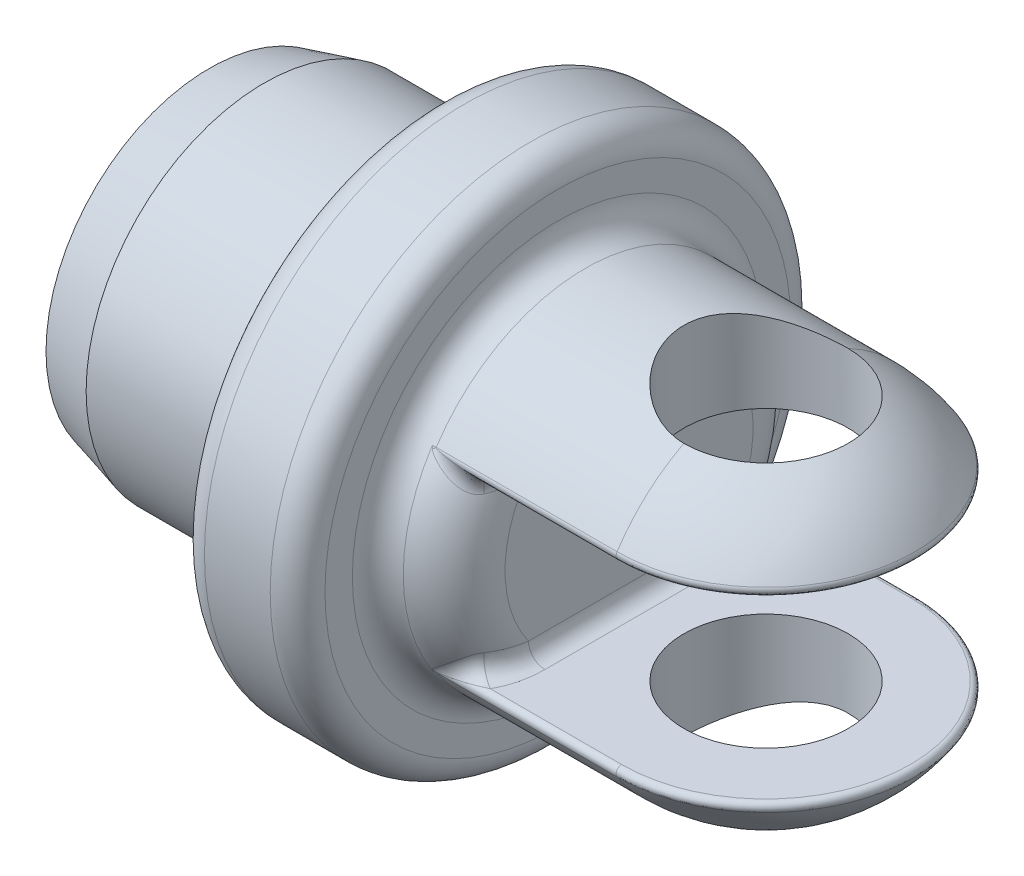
SolidWorks part; units mm, degrees
ref_plane "Plan de face" through (0, 0, 0) normal (0, 0, 1) x (1, 0, 0)
ref_plane "Plan de dessus" through (0, 0, 0) normal (0, 1, 0) x (1, 0, 0)
ref_plane "Plan de droite" through (0, 0, 0) normal (1, 0, 0) x (0, 0, -1)
sketch "Esquisse1" plane through (0, 0, 0) normal (0, 0, 1) x (1, 0, 0)
  line L0 (-118.3632, -0.002) -> (245.5511, -0.002) construction
  line L1 (-38.9994, -23.385) -> (-38.9994, -23.387)
  line L2 (-34.9994, -21.75) -> (-34.9994, -21.752)
  line L3 (-32.9994, -20.5953) -> (-32.9994, -20.5973)
  line L4 (-40.9994, -25.385) -> (-40.9994, -25.387)
  line L474 (-101.6, 21.9) -> (-101.6, 25.385)
  line L577 (-91.6, 32.5) -> (-65, 32.5)
  line L610 (-91.6, 32.5) -> (-101.6, 29.8205)
  line L618 (-101.6, 25.385) -> (-101.6, 29.8205)
  line L637 (-33, 32.5) -> (0, 32.5)
  line L639 (-43, 47.5) -> (-55, 47.5)
  line L640 (-60, 37.5) -> (-60, 42.5)
  line L643 (-38, 37.5) -> (-38, 42.5)
  line L2031 (-40.9994, 25.383) -> (-40.9994, 21.9)
  line L2033 (-38.9994, 23.383) -> (-38.9994, 21.748)
  line L2065 (-38.9994, 21.748) -> (-34.9994, 21.748)
  line L2066 (-40.9994, 25.383) -> (-38.9994, 23.383)
  line L2067 (-34.9994, 21.748) -> (-32.9994, 20.5933)
  line L4319 (-32.9994, 20.5953) -> (-32.9994, -0.002)
  line L4322 (-101.6, 21.9) -> (-40.9994, 21.9)
  line L4324 (-38.9994, 23.385) -> (-38.9994, 21.748)
  line L4325 (-40.9994, 25.385) -> (-38.9994, 23.385)
  line L4328 (-38.9994, 21.75) -> (-34.9994, 21.75)
  line L4329 (-34.9994, 21.75) -> (-32.9994, 20.5953)
  line L4331 (-34.9994, 21.75) -> (-34.9994, 21.748)
  line L4333 (-40.9994, 25.385) -> (-40.9994, 21.9)
  arc A88 (32.5, -0.002) -> (0, 32.5) centre (0, 0) ccw
  arc A133 (-55, 47.5) -> (-60, 42.5) centre (-55, 42.5) ccw
  arc A134 (-65, 32.5) -> (-60, 37.5) centre (-65, 37.5) ccw
  arc A137 (-38, 42.5) -> (-43, 47.5) centre (-43, 42.5) ccw
  arc A138 (-38, 37.5) -> (-33, 32.5) centre (-33, 37.5) ccw
  dimension "D1" = 32.5
revolve "Révolution1" add sketch "Esquisse1" angle 360 about L0
sketch "Esquisse2" plane through (0, 0, 0) normal (0, 1, 0) x (1, 0, 0)
  circle A0 centre (0, 0) radius 15
  dimension "D1" = 30
extrude "Extrusion1" cut sketch "Esquisse2" against normal mid plane 80
sketch "Esquisse3" plane through (0, 0, 0) normal (0, 0, 1) x (1, 0, 0)
  line L0 (-25, 16.25) -> (45.2382, 16.25)
  line L2 (-25, 16.25) -> (-25, -16.25)
  line L3 (-25, -16.25) -> (45.2382, -16.25)
  line L4 (45.2382, 16.25) -> (45.2382, -16.25)
  dimension "D1" = 32.5
  dimension "D2" = 25
extrude "Extrusion2" cut sketch "Esquisse3" against normal mid plane 94
fillet "Congé1" radius 10 2 edges at (-25, 0.0003, -32.502) (-25, 0.0003, 32.502)
fillet "Congé2" radius 1 10 edges at (-16.5, 16.25, -28.147) (-16.5, 16.25, 28.147) (-16.5, -16.25, 28.1493) (-16.5, -16.25, -28.1493) (-27.9172, -16.25, 3.5986) (-27.9153, 16.25, -3.595)
sketch "Esquisse4" plane through (-101.6, 0, 0) normal (-1, 0, 0) x (0, 0, 1)
  line L0 (0, 0) -> (0, 52.1903) construction
  line L1 (-2.055, 25.148) -> (-2.055, 17.272)
  line L2 (-2.055, 25.148) -> (2.055, 25.148)
  line L4 (-2.055, 17.272) -> (2.055, 17.272)
  line L5 (2.055, 25.148) -> (2.055, 17.272)
  circle A0 centre (0, -0.002) radius 21.902 construction
  dimension "D2" = 25.15
  dimension "D1" = 4.11
extrude "Extrusion3" cut sketch "Esquisse4" against normal up to next
pattern_circular "Répétition circulaire1" count 16 over 360 about axis through (0, -0.002, 0) along (1, 0, 0) of "Extrusion3"
fillet "Congé4" radius 3 14 edges at (-29.8895, -16.748, -26.3623) (-31.6296, -16.8389, -27.2722) (-30.6181, -16.4767, 26.9946) (-25.7204, -16.25, 20.7603) (-25, -16.25, 0) (-30.6205, 16.4775, -26.9931) (-25.72, 16.25, -20.7562) (-29.8895, 16.7479, 26.3599) (-31.6289, 16.8388, 27.2695) (-26.4676, 16.25, 22.6177) (-26.4673, -16.25, -22.6199) (-25, 16.25, 0)
